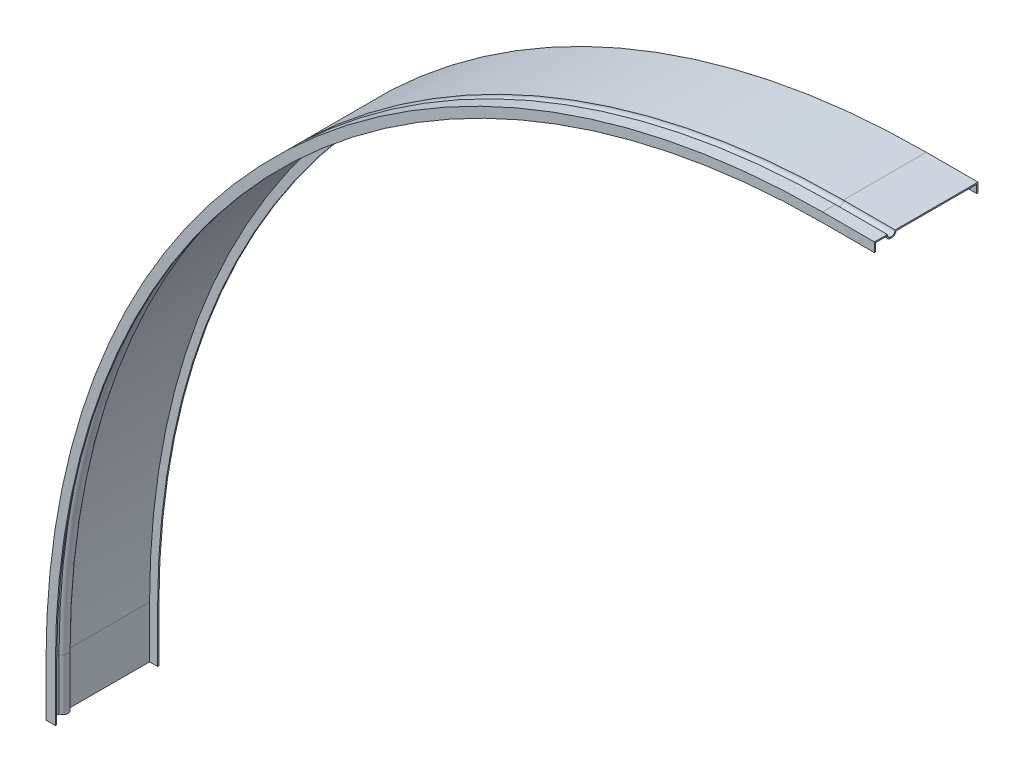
SolidWorks part; units mm, degrees
ref_plane "Front Plane" through (0, 0, 0) normal (0, 0, 1) x (1, 0, 0)
ref_plane "Top Plane" through (0, 0, 0) normal (0, 1, 0) x (1, 0, 0)
ref_plane "Right Plane" through (0, 0, 0) normal (1, 0, 0) x (0, 0, -1)
sketch "Sketch1" plane through (0, 0, 0) normal (0, 0, 1) x (1, 0, 0)
  line L0 (0, 0) -> (0, 50)
  line L1 (750, 800) -> (800, 800)
  line L2 (0, 0) -> (600, 0) construction
  line L3 (600, 0) -> (600, 50) construction
  line L4 (750, 200) -> (800, 200) construction
  line L5 (800, 200) -> (800, 800) construction
  arc A0 (0, 50) -> (750, 800) centre (750, 50) cw
  arc A1 (600, 50) -> (750, 200) centre (750, 50) cw construction
  dimension "D3" = 150
  dimension "D1" = 50
  dimension "D2" = 600
sketch "Sketch2" plane through (0, 0, 0) normal (0, 1, 0) x (1, 0, 0)
  line L0 (0, 0) -> (9, 0)
  line L1 (0, 0) -> (0, -80)
  line L2 (0, -87.572) -> (0, -100)
  line L3 (0, -100) -> (9, -100)
  line L4 (0, 0) -> (750, 0) construction
  line L5 (9, -100) -> (9, -98.786)
  line L6 (9, -98.786) -> (1.214, -98.786)
  line L7 (1.214, -98.786) -> (1.214, -88.6364)
  line L8 (1.214, -78.9356) -> (1.214, -1.214)
  line L9 (1.214, -1.214) -> (9, -1.214)
  line L10 (9, -1.214) -> (9, 0)
  arc A0 (0, -80) -> (0, -87.572) centre (0, -83.786) cw
  arc A1 (1.214, -88.6364) -> (1.214, -78.9356) centre (0, -83.786) ccw
  dimension "D1" = 5
  dimension "D8" = 1.214
  dimension "D2" = 15
  dimension "D3" = 9
  dimension "D4" = 100
  dimension "D5" = 1.214
  dimension "D6" = 1.214
  dimension "D7" = 1.214
sweep "Sweep1" add profiles "Sketch2" path "Sketch1"
